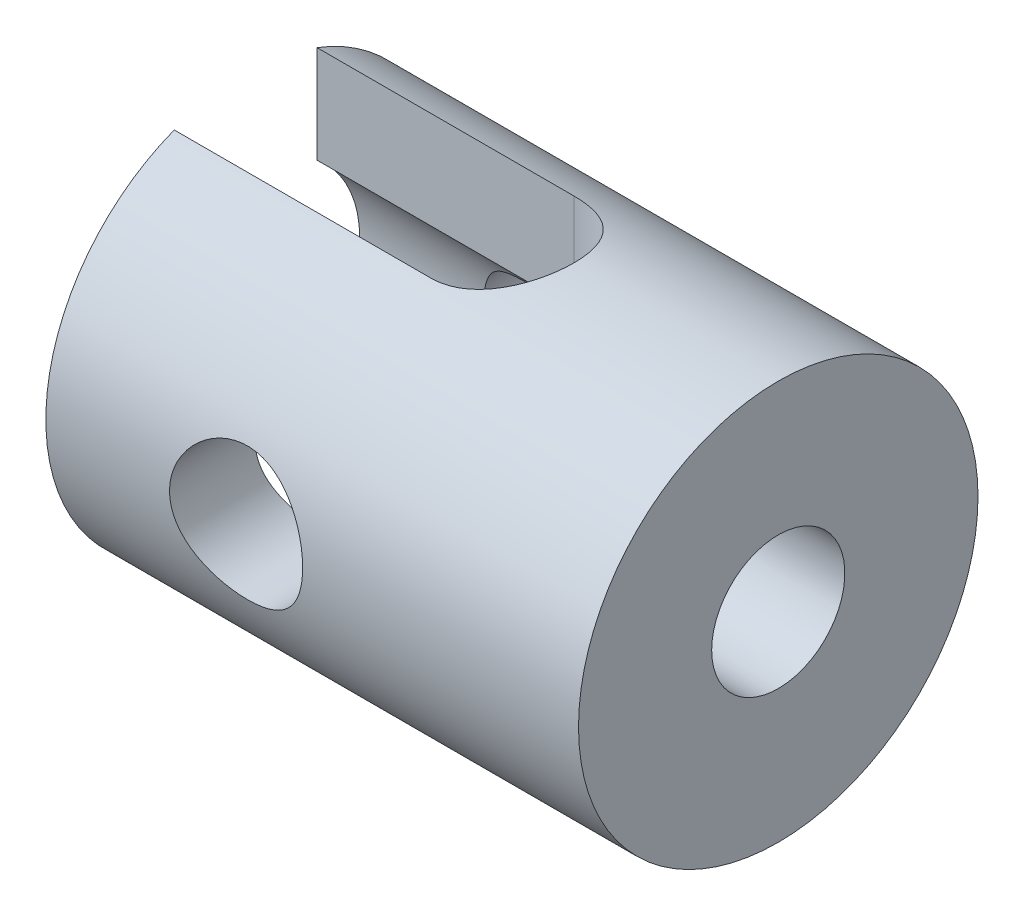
SolidWorks part; units mm, degrees
ref_plane "前视基准面" through (0, 0, 0) normal (0, 0, 1) x (1, 0, 0)
ref_plane "上视基准面" through (0, 0, 0) normal (0, 1, 0) x (1, 0, 0)
ref_plane "右视基准面" through (0, 0, 0) normal (1, 0, 0) x (0, 0, -1)
sketch "草图1" plane through (0, 0, 0) normal (1, 0, 0) x (0, 0, -1)
  circle A0 centre (0, 0) radius 84
extrude "拉伸1" add sketch "草图1" against normal blind 224
sketch "草图2" plane through (0, 0, 0) normal (0, 1, 0) x (1, 0, 0)
  line L1 (-241.5532, 30) -> (-116, 30)
  line L2 (-241.5532, 30) -> (-241.5532, -30)
  line L3 (-241.5532, -30) -> (-116, -30)
  line L5 (12.5948, 0) -> (-31.4926, 0) construction
  arc A0 (-116, 30) -> (-116, -30) centre (-116, 0) cw
  dimension "D2" = 60
extrude "切除-拉伸1" cut sketch "草图2" against normal through all and the other way through all
sketch "草图3" plane through (-224, 0, 0) normal (-1, 0, 0) x (0, 0, 1)
  circle A0 centre (0, 0) radius 28
extrude "切除-拉伸2" cut sketch "草图3" against normal through all
sketch "草图4" plane through (-224, 0, 0) normal (-1, 0, 0) x (0, 0, 1)
  circle A0 centre (0, 0) radius 48
extrude "切除-拉伸3" cut sketch "草图4" against normal blind 172
sketch "草图5" plane through (0, 0, 0) normal (0, 0, 1) x (1, 0, 0)
  line L0 (0, -84) -> (0, 84) construction
  circle A0 centre (-144, 0) radius 28
  dimension "D2" = 56
  dimension "D1" = 144
extrude "切除-拉伸4" cut sketch "草图5" against normal through all and the other way blind 224
